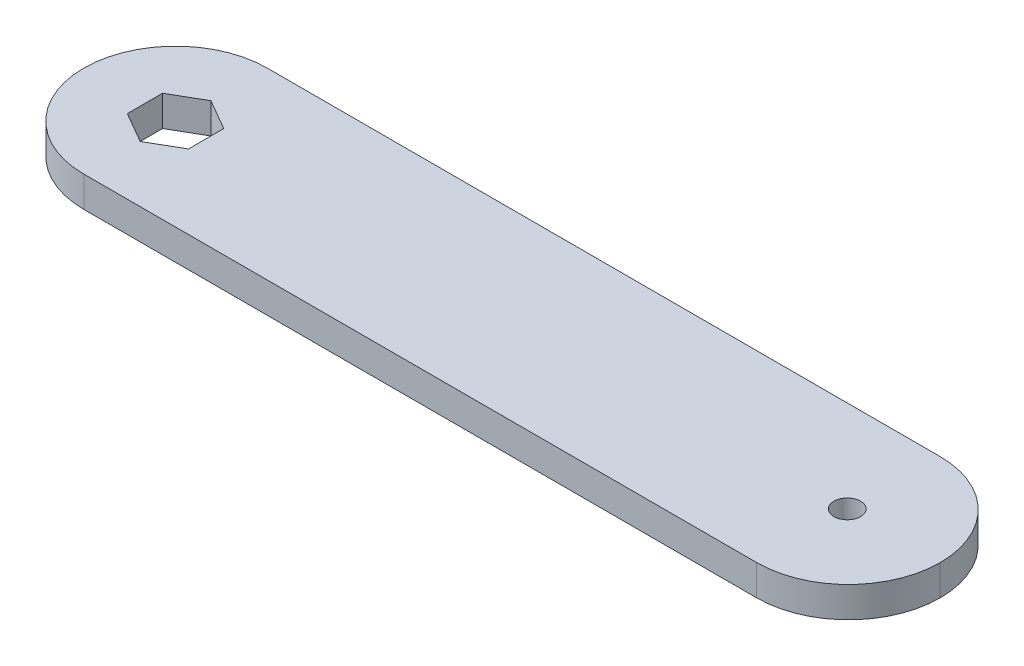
SolidWorks part; units mm, degrees
ref_plane "Front Plane" through (0, 0, 0) normal (0, 0, 1) x (1, 0, 0)
ref_plane "Top Plane" through (0, 0, 0) normal (0, 1, 0) x (1, 0, 0)
ref_plane "Right Plane" through (0, 0, 0) normal (1, 0, 0) x (0, 0, -1)
sketch "Sketch1" plane through (0, 0, 0) normal (0, 1, 0) x (1, 0, 0)
  line L0 (-18.9346, 9.525) -> (49981.0654, 9.525) construction
  line L1 (0, 0) -> (88.9, 0)
  line L2 (0, 0) -> (0, 19.05)
  line L3 (0, 19.05) -> (88.9, 19.05)
  line L4 (88.9, 0) -> (88.9, 19.05)
  line L5 (9.525, 13.1912) -> (6.35, 11.3581)
  line L6 (6.35, 11.3581) -> (6.35, 7.6919)
  line L7 (6.35, 7.6919) -> (9.525, 5.8588)
  line L8 (9.525, 5.8588) -> (12.7, 7.6919)
  line L9 (12.7, 7.6919) -> (12.7, 11.3581)
  line L10 (12.7, 11.3581) -> (9.525, 13.1912)
  circle A0 centre (9.525, 9.525) radius 3.175 construction
  circle A1 centre (79.248, 9.525) radius 1.3891
  point P14 (0, 9.525)
  point P15 (0, 9.525)
  dimension "D5" = 2.7781
  dimension "D1" = 6.35
  dimension "D2" = 19.05
  dimension "D3" = 9.525
  dimension "D4" = 88.9
  dimension "D6" = 9.652
extrude "Boss-Extrude1" add sketch "Sketch1" along normal blind 3.175
fillet "Fillet1" radius 9.525 4 edges at (88.9, 1.5875, -19.05) (88.9, 1.5875, 0) (0, 1.5875, 0) (0, 1.5875, -19.05)
